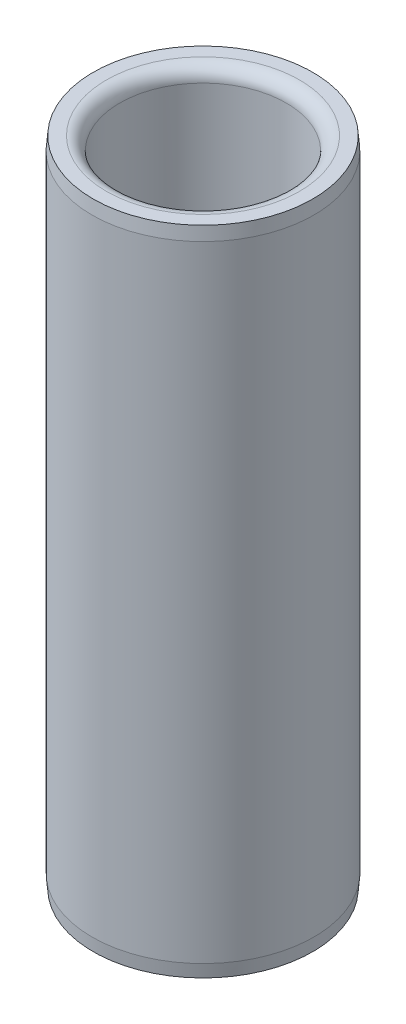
SolidWorks part; units mm, degrees
ref_plane "Front Plane" through (0, 0, 0) normal (0, 0, 1) x (1, 0, 0)
ref_plane "Top Plane" through (0, 0, 0) normal (0, 1, 0) x (1, 0, 0)
ref_plane "Right Plane" through (0, 0, 0) normal (1, 0, 0) x (0, 0, -1)
sketch "Sketch2" plane through (0, 0, 0) normal (0, 0, 1) x (1, 0, 0)
  line L0 (0, 20.0805) -> (0, -8.1046) construction
  line L1 (-19.0563, 0) -> (-25.4, 0)
  line L2 (-25.4, 0) -> (-25.4, 149.225)
  line L3 (-25.4, 149.225) -> (-19.0564, 149.225)
  line L4 (-19.0564, 149.225) -> (-19.0563, 0)
  dimension "D1" = 38.1127
  dimension "D2" = 50.8
  dimension "D3" = 149.225
revolve "Revolve1" add sketch "Sketch2" angle 360 about L0
chamfer "Chamfer1" [suppressed] distance 1.524 angle 15
chamfer "Chamfer2" distance 3.048 angle 5 2 edges at (0, 0, 25.4) (0, 149.225, 25.4)
fillet "Fillet1" radius 3.048 2 edges at (0, 0, 19.0563) (0, 149.225, 19.0564)
